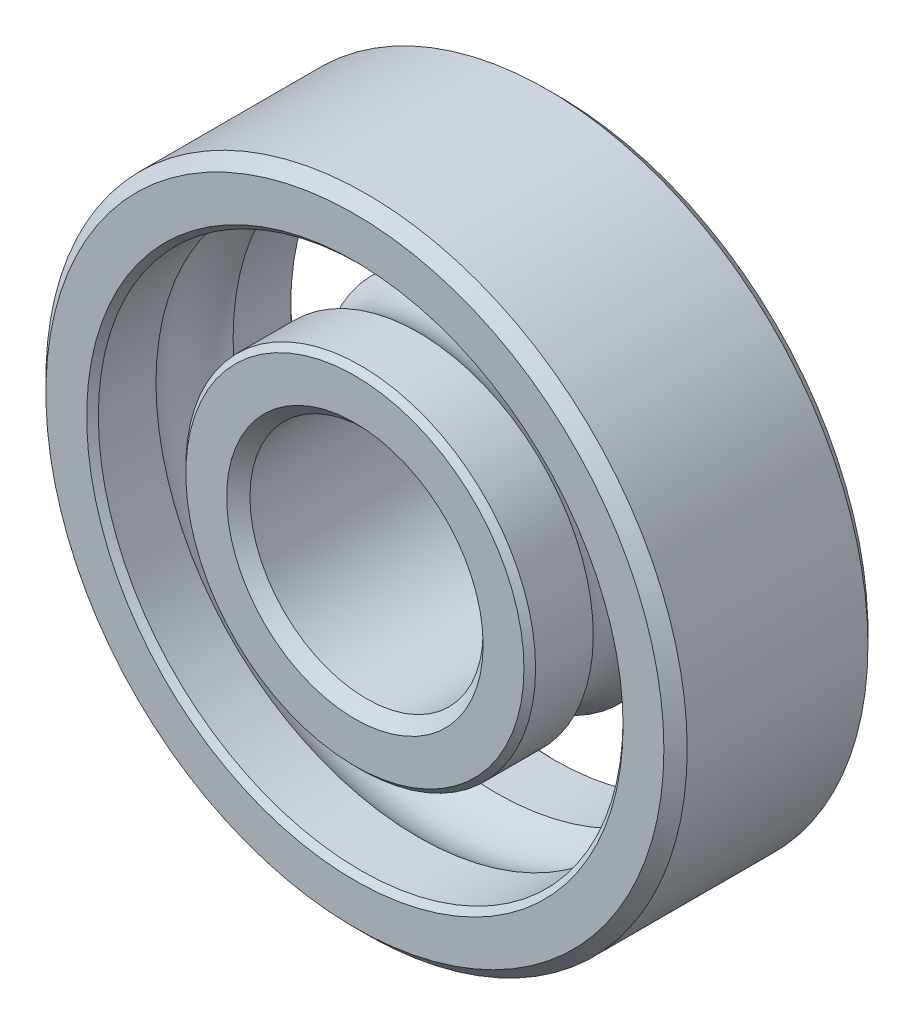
SolidWorks part; units mm, degrees
ref_plane "Front" through (0, 0, 0) normal (0, 0, 1) x (1, 0, 0)
ref_plane "Top" through (0, 0, 0) normal (0, 1, 0) x (1, 0, 0)
ref_plane "Right" through (0, 0, 0) normal (1, 0, 0) x (0, 0, -1)
sketch "Эскиз1" plane through (0, 0, 0) normal (0, 1, 0) x (1, 0, 0)
  line L0 (0, 0) -> (7.5, 0) construction
  line L1 (4, 3.5) -> (6, 3.5)
  line L2 (4, 3.5) -> (4, -3.5)
  line L3 (4, -3.5) -> (6, -3.5)
  line L4 (9, 3.5) -> (9, 1.3229)
  line L5 (0, 0) -> (0, 3.5) construction
  line L6 (7.5, 0) -> (7.5, 3.5) construction
  line L8 (6, 3.5) -> (6, 1.3229)
  line L9 (11, -3.5) -> (9, -3.5)
  line L10 (11, 3.5) -> (11, -3.5)
  line L11 (9, -1.3229) -> (9, -3.5)
  line L12 (11, 3.5) -> (9, 3.5)
  line L13 (6, -1.3229) -> (6, -3.5)
  arc A0 (9, -1.3229) -> (9, 1.3229) centre (7.5, 0) ccw
  arc A1 (6, -1.3229) -> (6, 1.3229) centre (7.5, 0) cw
  point P9 (4, 0)
  dimension "D4" = 4
  dimension "D1" = 4
  dimension "D2" = 7
  dimension "D3" = 11
  dimension "D5" = 2
revolve "Повернуть1" add sketch "Эскиз1" angle 360 about L5
chamfer "Фаска2" distance 0.4 angle 45 2 edges at (4, 0, -3.5) (4, 0, 3.5)
chamfer "Фаска3" distance 0.2 angle 45 2 edges at (6, 0, -3.5) (6, 0, 3.5)
chamfer "Фаска4" distance 0.2 angle 45 2 edges at (9, 0, 3.5) (9, 0, -3.5)
chamfer "Фаска5" distance 0.4 angle 45 2 edges at (11, 0, 3.5) (11, 0, -3.5)
